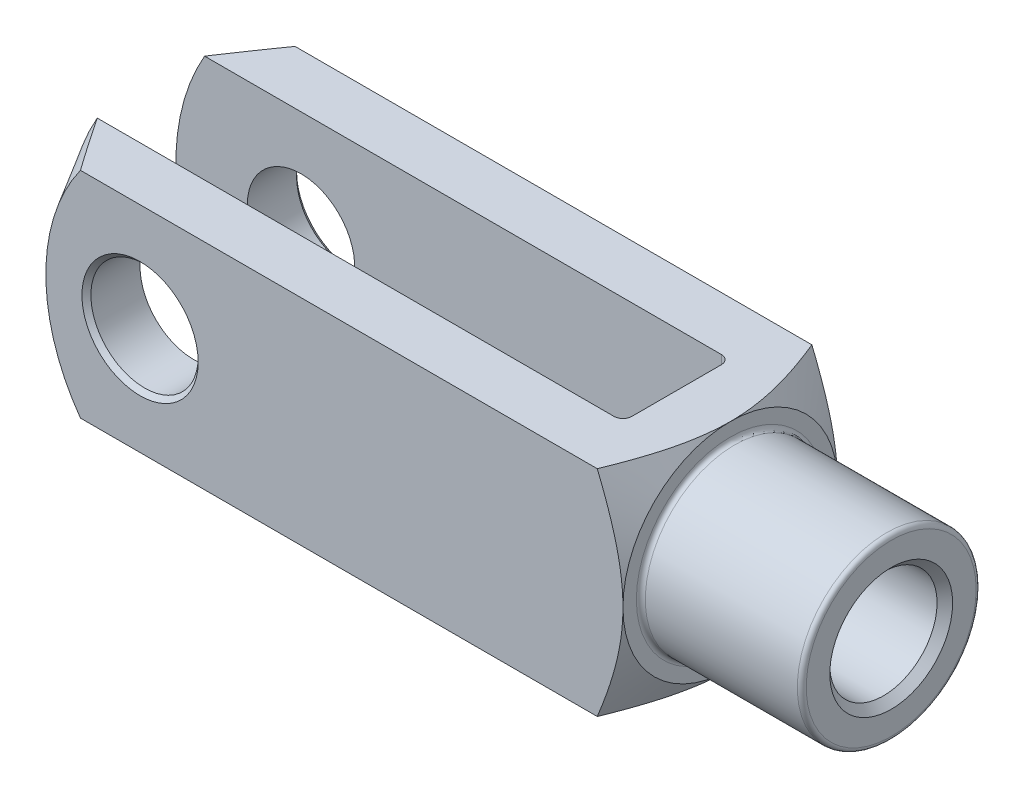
SolidWorks part; units mm, degrees
ref_plane "Front Plane" through (0, 0, 0) normal (0, 0, 1) x (1, 0, 0)
ref_plane "Top Plane" through (0, 0, 0) normal (0, 1, 0) x (1, 0, 0)
ref_plane "Right Plane" through (0, 0, 0) normal (1, 0, 0) x (0, 0, -1)
sketch "Sketch1" plane through (0, 0, 0) normal (1, 0, 0) x (0, 0, -1)
  line L0 (0, 0) -> (0, 50000) construction
  line L1 (0, 0) -> (50000, 0) construction
  line L2 (-12, -12) -> (-12, 12)
  line L3 (-12, 12) -> (12, 12)
  line L4 (12, -12) -> (12, 12)
  line L5 (-12, -12) -> (12, -12)
  point P9 (0, 12)
  point P11 (12, 0)
  point P12 (-12, 0)
  dimension "D1" = 24
  dimension "D2" = 24
extrude "Extrude1" add sketch "Sketch1" against normal blind 86
sketch "Sketch2" plane through (0, 0, 0) normal (1, 0, 0) x (0, 0, -1)
  circle A0 centre (0, 0) radius 10
  circle A1 centre (0, 0) radius 20
  dimension "D1" = 20
  dimension "D2" = 40
extrude "Extrude2" cut sketch "Sketch2" against normal blind 18
sketch "Sketch3" plane through (0, 0, 12) normal (0, 0, 1) x (1, 0, 0)
  circle A0 centre (-72, 0) radius 6
  dimension "D1" = 12
  dimension "D2" = 72
extrude "Extrude3" cut sketch "Sketch3" against normal through all
sketch "Sketch4" plane through (0, 12, 0) normal (0, 1, 0) x (1, 0, 0)
  line L0 (0, 0) -> (-50000, 0) construction
  line L1 (-86, -6) -> (-86, 6)
  line L2 (-86, 12) -> (-86, -12) construction
  line L3 (-86, 6) -> (-24, 6)
  line L4 (-24, 6) -> (-24, -6)
  line L5 (-72, 12) -> (-72, -12) construction
  line L6 (-86, -6) -> (-24, -6)
  point P7 (-72, 0)
  point P13 (-24, 0)
  point P14 (-86, 0)
  dimension "D1" = 48
  dimension "D2" = 12
extrude "Extrude4" cut sketch "Sketch4" against normal through all
fillet "Fillet1" radius 1 2 edges at (-24, 0, 6) (-24, 0, -6)
fillet "Fillet2" radius 0.5 2 edges at (0, 0, -10) (-18, 0, -10)
chamfer "Chamfer2" distance 0.5 angle 45 2 edges at (-66, 0, -12) (-66, 0, 12)
sketch "Sketch6" plane through (0, 0, 0) normal (0, 0, 1) x (1, 0, 0)
  line L0 (-18, -12) -> (-18, -24)
  line L1 (-18, -24) -> (-24.9282, -24)
  line L2 (-24.9282, -24) -> (-18, -12)
  dimension "D1" = 30
  dimension "D2" = 24
revolve "Cut-Revolve1" cut sketch "Sketch6" angle 360 about axis through (-18, 0, 0) along (1, 0, 0)
sketch "Sketch7" plane through (0, 0, 0) normal (0, 1, 0) x (1, 0, 0)
  line L0 (-82.5359, -12) -> (-86, -6)
  line L1 (-86, 6) -> (-82.5359, 12)
  line L2 (-82.5359, 12) -> (-110, 12)
  line L3 (-86, 6) -> (-86, -6)
  line L4 (-110, 12) -> (-110, -12)
  line L5 (-110, -12) -> (-82.5359, -12)
  line L6 (-86, 12) -> (-20.8698, 12) construction
  line L7 (-86, -12) -> (-20.8698, -12) construction
  line L8 (-62, 0.6162) -> (-62, 50000.6162) construction
  dimension "D1" = 120
  dimension "D2" = 24
  dimension "D3" = 24
revolve "Cut-Revolve2" cut sketch "Sketch7" angle 180 about L8
sketch "Sketch8" plane through (0, 0, 0) normal (1, 0, 0) x (0, 0, -1)
  circle A0 centre (0, 0) radius 6
  dimension "D1" = 12
extrude "Extrude5" cut sketch "Sketch8" against normal through all
chamfer "Chamfer3" distance 0.87 angle 45 1 edges at (0, 0, -6)
equation "\"D2@Sketch1\" = \"D1@Sketch1\""
equation "\"D2@Sketch2\" = \"D1@Sketch2\"*2"
equation "\"D2@Sketch6\" = \"D1@Sketch1\""
equation "\"D2@Sketch7\" = \"D1@Sketch1\""
equation "\"D3@Sketch7\" = \"D1@Sketch1\""
